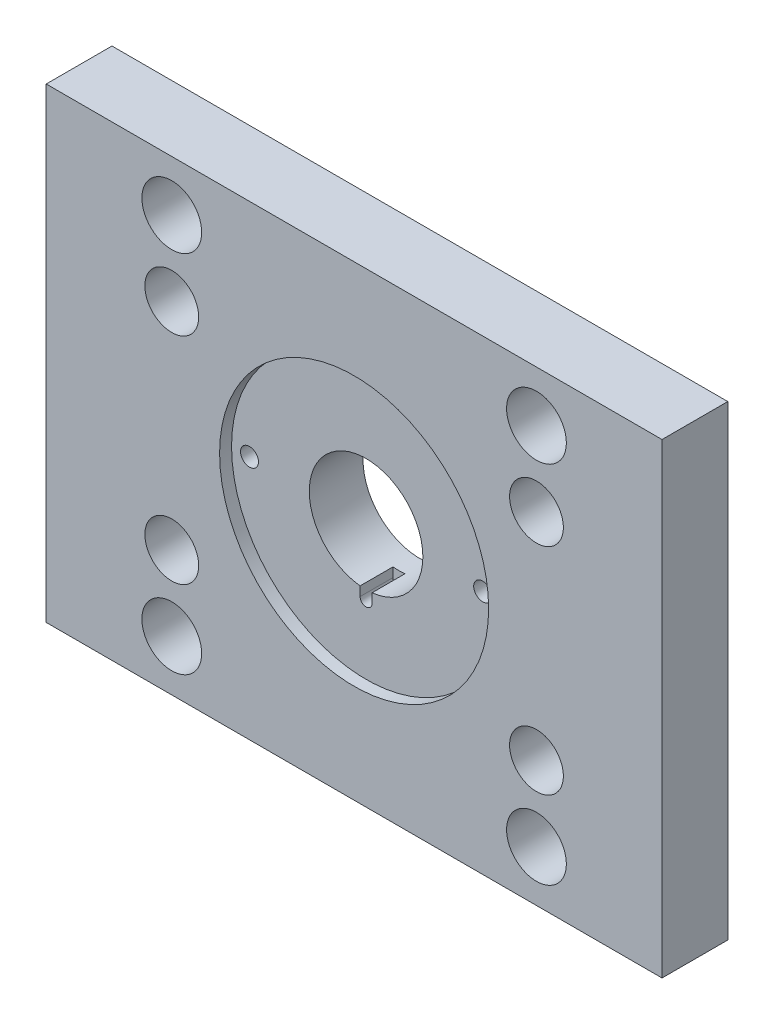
SolidWorks part; units mm, degrees
ref_plane "Plan de face" through (0, 0, 0) normal (0, 0, 1) x (1, 0, 0)
ref_plane "Plan de dessus" through (0, 0, 0) normal (0, 1, 0) x (1, 0, 0)
ref_plane "Plan de droite" through (0, 0, 0) normal (1, 0, 0) x (0, 0, -1)
sketch "Esquisse1" plane through (0, 0, 0) normal (0, 0, 1) x (1, 0, 0)
  line L1 (-103, 78) -> (103, 78)
  line L2 (-103, 78) -> (-103, -78)
  line L3 (-103, -78) -> (103, -78)
  line L4 (103, 78) -> (103, -78)
  dimension "D1" = 78
  dimension "D2" = 78
  dimension "D3" = 103
  dimension "D5" = 103
extrude "Extrusion1" add sketch "Esquisse1" along normal blind 22
sketch "Esquisse5" plane through (0, 0, 22) normal (0, 0, 1) x (1, 0, 0)
  circle A0 centre (-61, 61) radius 10
  dimension "D2" = 20
  dimension "D5" = 61
  dimension "D9" = 61
extrude "Enlèv. mat.-Extru.3" cut sketch "Esquisse5" against normal through all
pattern_linear "Répétition linéaire3" count 2 spacing 122 along (1, 0, 0) count 2 spacing 122 along (0, -1, 0) of "Enlèv. mat.-Extru.3"
sketch "Esquisse7" plane through (0, 0, 22) normal (0, 0, 1) x (1, 0, 0)
  circle A0 centre (-61, 36) radius 5
  dimension "D1" = 10
  dimension "D2" = 61
  dimension "D3" = 36
extrude "Enlèv. mat.-Extru.4" cut sketch "Esquisse7" against normal through all
sketch "Esquisse8" plane through (0, 0, 22) normal (0, 0, 1) x (1, 0, 0)
  circle A0 centre (-61, 36) radius 9
  dimension "D1" = 18
  dimension "D2" = 61
  dimension "D3" = 36
extrude "Enlèv. mat.-Extru.5" cut sketch "Esquisse8" against normal blind 13
pattern_linear "Répétition linéaire1" count 2 spacing 122 along (1, 0, 0) count 2 spacing 72 along (0, -1, 0) of "Enlèv. mat.-Extru.5", "Enlèv. mat.-Extru.4"
sketch "Esquisse9" plane through (0, 0, 22) normal (0, 0, 1) x (1, 0, 0)
  circle A0 centre (0, 0) radius 19
  dimension "D1" = 38
extrude "Enlèv. mat.-Extru.6" cut sketch "Esquisse9" against normal through all
sketch "Esquisse11" plane through (0, 0, 22) normal (0, 0, 1) x (1, 0, 0)
  circle A0 centre (0, 0) radius 45
  dimension "D1" = 90
extrude "Enlèv. mat.-Extru.7" cut sketch "Esquisse11" against normal blind 4
sketch "Esquisse12" plane through (0, 0, 18) normal (0, 0, 1) x (1, 0, 0)
  circle A0 centre (-39, 0) radius 3
  dimension "D1" = 6
  dimension "D2" = 39
extrude "Enlèv. mat.-Extru.8" cut sketch "Esquisse12" against normal blind 20
pattern_linear "Répétition linéaire2" count 2 spacing 78 along (1, 0, 0) of "Enlèv. mat.-Extru.8"
sketch "Esquisse13" plane through (0, 0, 18) normal (0, 0, 1) x (1, 0, 0)
  line L1 (-2, -18) -> (2, -18)
  line L2 (-2, -18) -> (-2, -22)
  line L4 (2, -18) -> (2, -22)
  arc A0 (2, -22) -> (-2, -22) centre (0, -22) cw
  circle A1 centre (0, 0) radius 19 construction
  dimension "D4" = 22
  dimension "D1" = 2
  dimension "D2" = 2
  dimension "D3" = 18
extrude "Enlèv. mat.-Extru.9" cut sketch "Esquisse13" against normal blind 11
